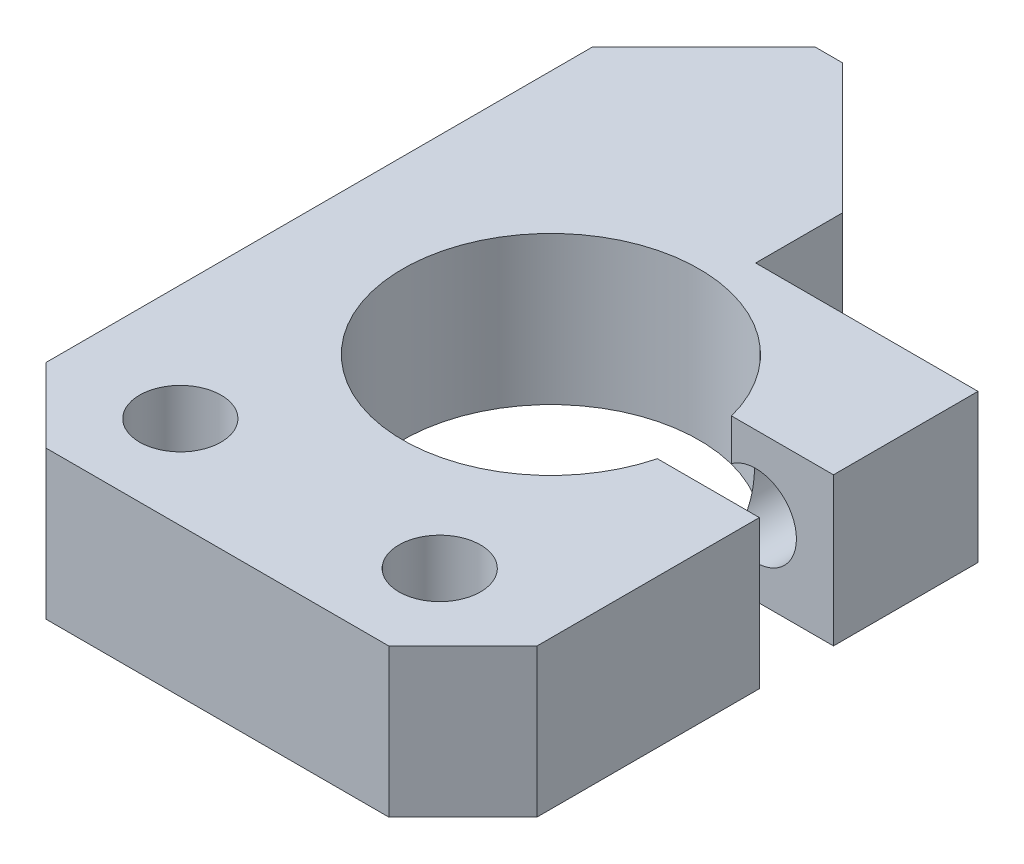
SolidWorks part; units mm, degrees
ref_plane "Front Plane" through (0, 0, 0) normal (0, 0, 1) x (1, 0, 0)
ref_plane "Top Plane" through (0, 0, 0) normal (0, 1, 0) x (1, 0, 0)
ref_plane "Right Plane" through (0, 0, 0) normal (1, 0, 0) x (0, 0, -1)
sketch "Sketch1" plane through (0, 0, 0) normal (0, 1, 0) x (1, 0, 0)
  line L0 (4.625, -9) -> (-4.625, -9)
  line L1 (-6.625, -7) -> (-6.625, 7.75)
  line L2 (-3.625, 10.75) -> (-2.875, 10.75)
  line L3 (0.625, 7.25) -> (0.625, 4.9)
  line L4 (0.625, 4.9) -> (6.625, 4.9)
  line L5 (6.625, 4.9) -> (6.625, 1)
  line L6 (6.625, 1) -> (3.873, 1)
  line L7 (6.625, -7) -> (6.625, -1)
  line L8 (6.625, -1) -> (3.873, -1)
  line L9 (-4.625, -9) -> (-6.625, -7)
  line L10 (6.625, -7) -> (4.625, -9)
  line L11 (-6.625, 7.75) -> (-3.625, 10.75)
  line L12 (-2.875, 10.75) -> (0.625, 7.25)
  arc A0 (3.873, 1) -> (3.873, -1) centre (0, 0) ccw
  circle A1 centre (-3.5, -6.5) radius 1.1
  circle A2 centre (3.5, -6.5) radius 1.1
  point P3 (6.625, -9)
  point P4 (-6.625, -9)
  point P6 (-6.625, 10.75)
  point P7 (0.625, 10.75)
  dimension "D1" = 8
  dimension "D13" = 2.2
  dimension "D14" = 2.2
  dimension "D2" = 13.25
  dimension "D3" = 19.75
  dimension "D4" = 9
  dimension "D5" = 6.625
  dimension "D6" = 7.25
  dimension "D7" = 3.9
  dimension "D8" = 2
  dimension "D9" = 1
  dimension "D10" = 7
  dimension "D11" = 3.125
  dimension "D12" = 2.5
extrude "Boss-Extrude1" add sketch "Sketch1" along normal blind 4
hole_wizard "Ø2.0mm Dowel Hole1" positions "3DSketch1" profile "Sketch2" hole size "Ø2.0" standard "ANSI Metric"
sketch3d "3DSketch1"
  line L0 (6.625, 4, -4.9) -> (6.625, 0, -4.9) construction
  line L1 (6.625, 0, -4.9) -> (0.625, 0, -4.9) construction
  point P0 (4.525, 2, -4.9)
  dimension "D1" = 2.1
  dimension "D2" = 2
sketch "Sketch2" plane through (4.525, 2, -4.9) normal (1, 0, 0) x (0, 1, 0)
  line L0 (0, 0) -> (0, 3.9)
  line L1 (0, 3.9) -> (1.1, 3.9)
  line L2 (1.1, 3.9) -> (1.1, 0)
  line L5 (1.1, 0) -> (0, 0)
  line L11 (0, -6.35) -> (0, 107.95) construction
  dimension "Thru Hole Dia." = 2.2
  dimension "Thru Hole Depth" = 3.9
hole_wizard "M2x0.4 Tapped Hole1" positions "3DSketch2" profile "Sketch3" tap size "M2x0.4" standard "ANSI Metric"
sketch3d "3DSketch2"
  line L0 (6.625, 4, 1) -> (6.625, 0, 1) construction
  line L1 (6.625, 4, 1) -> (3.873, 4, 1) construction
  point P0 (4.525, 2, 1)
  dimension "D1" = 2.1
  dimension "D2" = 2
sketch "Sketch3" plane through (4.525, 2, 1) normal (1, 0, 0) x (0, 1, 0)
  line L0 (0, 0) -> (0, 4.4807)
  line L1 (0, 4.4807) -> (0.8, 4)
  line L2 (0.8, 4) -> (0.8, 0)
  line L5 (0.8, 0) -> (0, 0)
  line L10 (0, 4.4807) -> (-0.8, 4) construction
  line L11 (0, -6.35) -> (0, 107.95) construction
  dimension "Tap Drill Dia." = 1.6
  dimension "Tap Drill Depth" = 4
  dimension "Drill Angle" = 118
